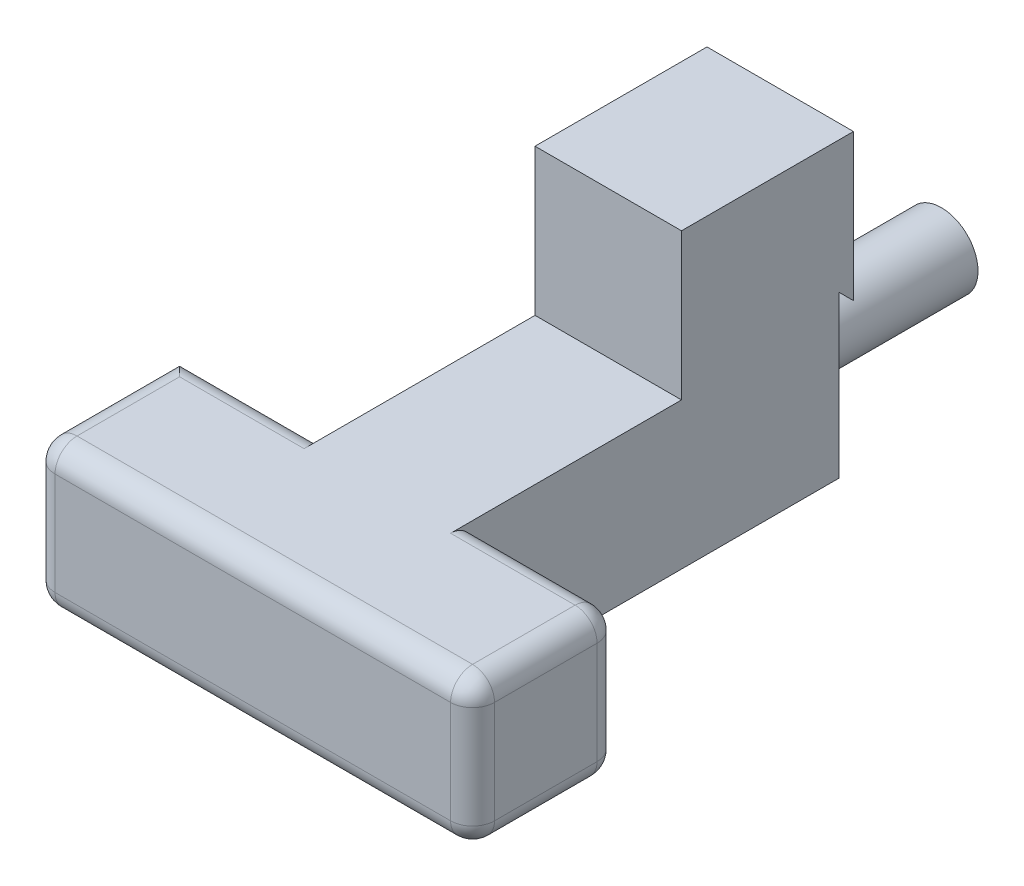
SolidWorks part; units mm, degrees
ref_plane "Front Plane" through (0, 0, 0) normal (0, 0, 1) x (1, 0, 0)
ref_plane "Top Plane" through (0, 0, 0) normal (0, 1, 0) x (1, 0, 0)
ref_plane "Right Plane" through (0, 0, 0) normal (1, 0, 0) x (0, 0, -1)
sketch "Sketch1" plane through (0, 0, 0) normal (0, 1, 0) x (1, 0, 0)
  line L0 (0, 0) -> (0, -32.9299) construction
  line L1 (10, -25) -> (-10, -25)
  line L2 (10, -25) -> (10, 25)
  line L3 (10, 25) -> (-10, 25)
  line L4 (-10, -25) -> (-10, 25)
  line L5 (10, -25) -> (-10, 25) construction
  line L6 (10, 25) -> (-10, -25) construction
  point P0 (0, 0)
  dimension "D1" = 50
  dimension "D2" = 20
extrude "Boss-Extrude1" add sketch "Sketch1" along normal mid plane 20
sketch "Sketch2" plane through (0, 0, 0) normal (0, 1, 0) x (1, 0, 0)
  line L0 (0, 0) -> (0, -35) construction
  line L2 (30, -45) -> (-30, -45)
  line L3 (30, -45) -> (30, -25)
  line L4 (30, -25) -> (-30, -25)
  line L5 (-30, -45) -> (-30, -25)
  line L6 (30, -45) -> (-30, -25) construction
  line L7 (30, -25) -> (-30, -45) construction
  dimension "D1" = 20
  dimension "D2" = 60
  dimension "D3" = 35
extrude "Boss-Extrude2" add sketch "Sketch2" along normal mid plane 20
sketch "Sketch4" plane through (0, 0, -25) normal (0, 0, -1) x (-1, 0, 0)
  circle A0 centre (0, 0) radius 5
  dimension "D1" = 10
sketch "Sketch5" plane through (0, 10, 0) normal (0, 1, 0) x (1, 0, 0)
  line L0 (0, 0) -> (0, 15.262) construction
  line L1 (10, 25) -> (-10, 25) construction
  line L2 (-10, 3.524) -> (10, 3.524)
  line L3 (-10, 3.524) -> (-10, 27)
  line L4 (-10, 27) -> (10, 27)
  line L5 (10, 3.524) -> (10, 27)
  line L6 (-10, 3.524) -> (10, 27) construction
  line L7 (-10, 27) -> (10, 3.524) construction
  dimension "D1" = 2
extrude "Boss-Extrude3" add sketch "Sketch5" along normal blind 20
fillet "Fillet2" radius 3 13 edges at (30, 0, 45) (-30, -10, 35) (-20, -10, 25) (20, -10, 25) (30, -10, 35) (20, 10, 25) (30, 10, 35) (-30, 0, 45) (0, 10, 45) (-20, 10, 25) (-30, 10, 35) (30, 0, 25) (0, -10, 45)
sketch "Sketch6" plane through (0, 0, 0) normal (1, 0, 0) x (0, 0, -1)
  line L0 (27, 10) -> (25, 10)
  line L1 (27, 30) -> (27, 10) construction
  line L2 (25, 10) -> (25, 12)
  line L3 (25, 12) -> (27, 10)
  dimension "D1" = 2
extrude "Cut-Extrude2" cut sketch "Sketch6" against normal mid plane 20
extrude "Boss-Extrude4" add sketch "Sketch4" along normal blind 24
